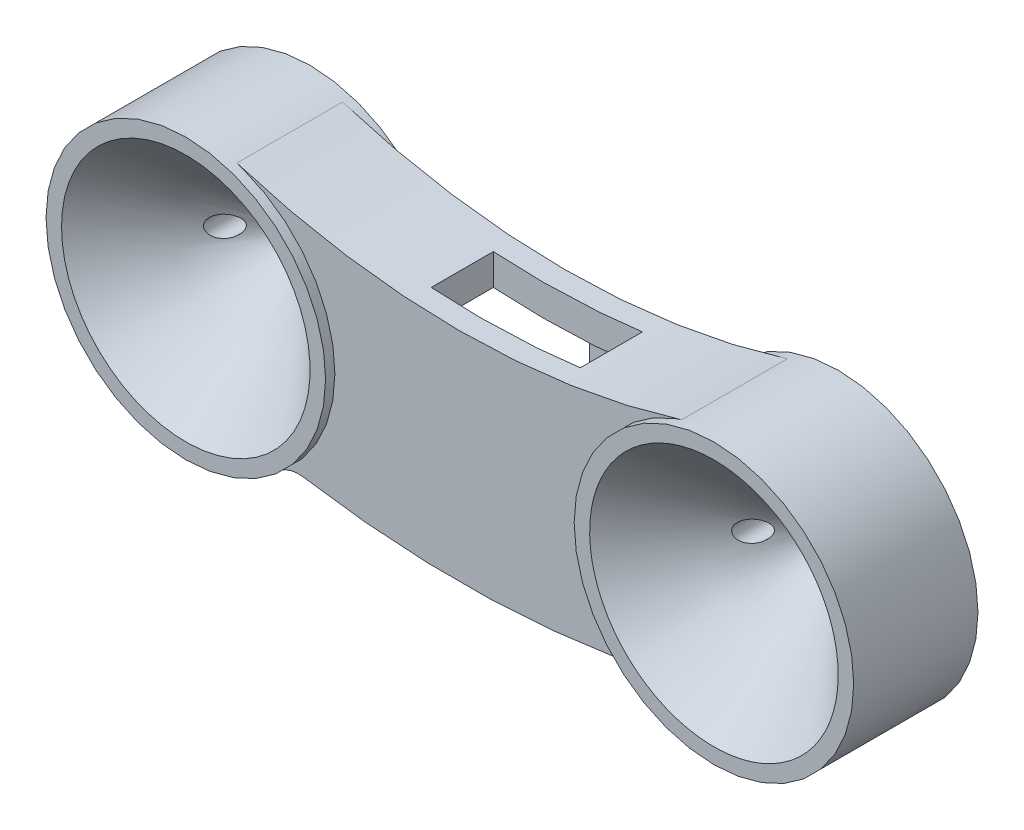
SolidWorks part; units mm, degrees
ref_plane "Front Plane" through (0, 0, 0) normal (0, 0, 1) x (1, 0, 0)
ref_plane "Top Plane" through (0, 0, 0) normal (0, 1, 0) x (1, 0, 0)
ref_plane "Right Plane" through (0, 0, 0) normal (1, 0, 0) x (0, 0, -1)
sketch "Sketch1" plane through (0, 0, 0) normal (0, 0, 1) x (1, 0, 0)
  line L0 (0, 0) -> (0, 25722.3892) construction
  circle A0 centre (-50, 0) radius 22.5
  circle A1 centre (50, 0) radius 22.5
  dimension "D1" = 100
  dimension "D2" = 45
extrude "Boss-Extrude1" add sketch "Sketch1" along normal mid plane 20
sketch "Sketch2" plane through (0, 0, 0) normal (0, 0, 1) x (1, 0, 0)
  arc A0 (-42.1053, 21.0695) -> (42.1053, 21.0695) centre (0, 133.4401) ccw
  circle A1 centre (-50, 0) radius 22.5 construction
  circle A2 centre (50, 0) radius 22.5 construction
  dimension "D1" = 120
extrude "Extrude-Thin1" add sketch "Sketch2" along normal mid plane 17 thin
sketch "Sketch3" plane through (0, 0, 0) normal (0, 0, 1) x (1, 0, 0)
  arc A1 (42.1053, 21.0695) -> (35.7202, -17.3879) centre (50, 0) ccw construction
  arc A2 (-43.8596, 16.3874) -> (43.8596, 16.3874) centre (0, 133.4401) ccw
  arc A3 (-31.2276, 12.4036) -> (31.2276, 12.4036) centre (0, 133.4401) ccw
  arc A4 (-35.7202, -17.3879) -> (-42.1053, 21.0695) centre (-50, 0) ccw construction
  arc A5 (31.2276, 12.4036) -> (31.7507, -13.1611) centre (50, 0) ccw
  arc A6 (-31.7507, -13.1611) -> (-31.2276, 12.4036) centre (-50, 0) ccw
  arc A9 (-34.568, -12.5225) -> (34.568, -12.5225) centre (0, 133.4401) ccw
  arc A10 (-31.7507, -13.1611) -> (31.7507, -13.1611) centre (0, 133.4401) ccw
  dimension "D1" = 5
  dimension "D2" = 5
sketch "Sketch4" plane through (0, 0, -10) normal (0, 0, -1) x (-1, 0, 0)
  circle A0 centre (50, 0) radius 12
  circle A1 centre (-50, 0) radius 12
  dimension "D1" = 24
extrude "Cut-Extrude2" cut sketch "Sketch3" against normal mid plane 11
extrude "Cut-Extrude1" cut sketch "Sketch4" against normal blind 2
sketch "Sketch5" plane through (0, 0, 10) normal (0, 0, 1) x (1, 0, 0)
  circle A0 centre (-50, 0) radius 20
  dimension "D1" = 40
ref_plane "Plane1" through (0, 0, -8) normal (0, 0, 1) x (1, 0, 0)
sketch "Sketch6" plane through (0, 0, -8) normal (0, 0, 1) x (1, 0, 0)
  circle A0 centre (-50, 0) radius 2.5
  dimension "D1" = 5
loft "Cut-Loft1" cut profiles "Sketch5", "Sketch6"
mirror "Mirror1" about plane through (0, 0, 0) normal (1, 0, 0) of "Cut-Loft1"
sketch "Sketch7" plane through (0, 0, 0) normal (0, 1, 0) x (1, 0, 0)
  line L1 (-0.5, -5) -> (23.5, -5)
  line L2 (-0.5, -5) -> (-0.5, 5)
  line L3 (-0.5, 5) -> (23.5, 5)
  line L4 (23.5, -5) -> (23.5, 5)
  line L5 (-0.5, -5) -> (23.5, 5) construction
  line L6 (-0.5, 5) -> (23.5, -5) construction
  point P0 (11.5, 0)
  dimension "D1" = 10
  dimension "D2" = 24
  dimension "D3" = 4
extrude "Cut-Extrude3" cut sketch "Sketch7" along normal through all
sketch "Sketch8" plane through (0, 0, -8.5) normal (0, 0, -1) x (-1, 0, 0)
  line L1 (0.5, -0.9576) -> (24.5, -0.9576)
  line L2 (0.5, -0.9576) -> (0.5, 9.0424)
  line L3 (0.5, 9.0424) -> (24.5, 9.0424)
  line L4 (24.5, -0.9576) -> (24.5, 9.0424)
  line L5 (0.5, -0.9576) -> (24.5, 9.0424) construction
  line L6 (0.5, 9.0424) -> (24.5, -0.9576) construction
  arc A4 (-42.1053, 21.0695) -> (42.1053, 21.0695) centre (0, 133.4401) ccw construction
  circle A7 centre (50, 0) radius 22.5 construction
  point P0 (12.5, 4.0424)
  dimension "D1" = 10
  dimension "D2" = 24
  dimension "D3" = 10
  dimension "D4" = 15
extrude "Cut-Extrude4" cut sketch "Sketch8" against normal up to surface (3 mm away)
hole_wizard "M3 Clearance Hole1" positions "Sketch9" profile "Sketch10" hole size "M3" standard "ISO"
sketch "Sketch9" plane through (0, 0, -8) normal (0, 0, -1) x (-1, 0, 0)
  line L0 (-57, 0) -> (-50, 0) construction
  line L2 (0, -21.5599) -> (0, 13.4401) construction
  circle A0 centre (-50, 0) radius 2.5 construction
  arc A1 (-35.7202, -17.3879) -> (35.7202, -17.3879) centre (0, 133.4401) ccw construction
  arc A2 (-42.1053, 21.0695) -> (42.1053, 21.0695) centre (0, 133.4401) ccw construction
  point P0 (-57, 0)
  point P2 (-43, 0)
  point P28 (43, 0)
  point P29 (57, 0)
  dimension "D2" = 7
  dimension "D1" = 14
sketch "Sketch10" plane through (57, 0, -8) normal (1, 0, 0) x (0, 1, 0)
  line L0 (0, 0) -> (0, 18.0001)
  line L1 (0, 18.0001) -> (1.7, 18.0001)
  line L2 (1.7, 18.0001) -> (1.7, 0)
  line L5 (1.7, 0) -> (0, 0)
  line L11 (0, -6.35) -> (0, 107.95) construction
  dimension "Thru Hole Dia." = 3.4
  dimension "Thru Hole Depth" = 18.0001
fillet "Fillet1" radius 5 2 edges at (35.7202, -17.3879, 0) (-35.7202, -17.3879, 0)
